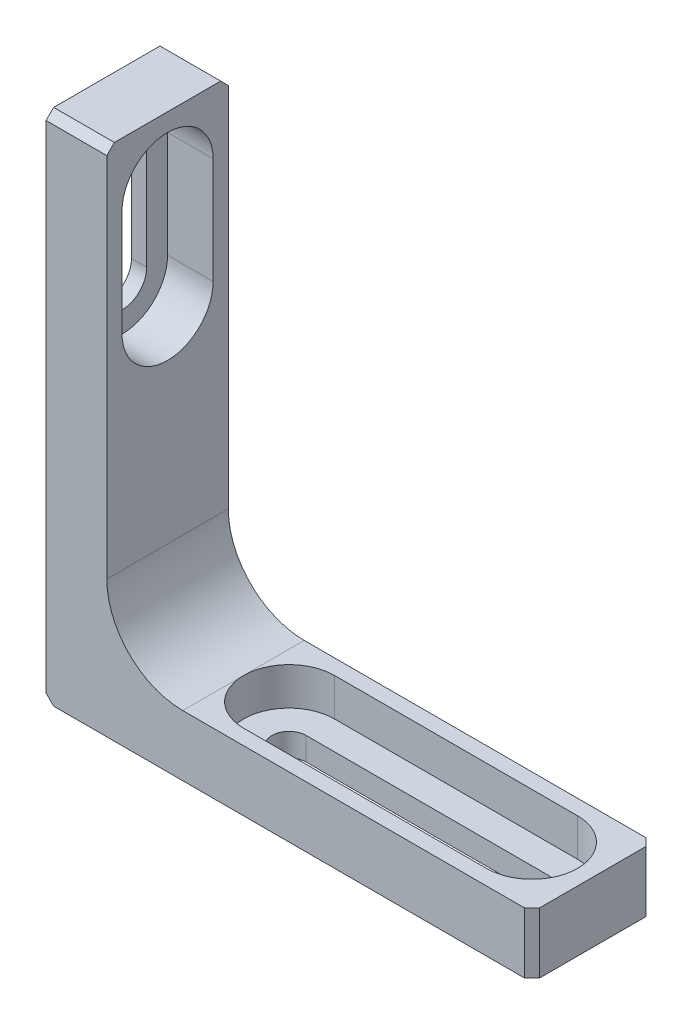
SolidWorks part; units mm, degrees
ref_plane "Front" through (0, 0, 0) normal (0, 0, 1) x (1, 0, 0)
ref_plane "Top" through (0, 0, 0) normal (0, 1, 0) x (1, 0, 0)
ref_plane "Right" through (0, 0, 0) normal (1, 0, 0) x (0, 0, -1)
sketch "Sketch1" plane through (0, 0, 0) normal (0, 0, 1) x (1, 0, 0)
  line L1 (0, 0) -> (101.6, 0)
  line L2 (0, 0) -> (0, 106.8288)
  line L3 (0, 106.8288) -> (101.6, 106.8288)
  line L4 (101.6, 0) -> (101.6, 106.8288)
  dimension "D1" = 106.8288
  dimension "D2" = 101.6
extrude "Boss-Extrude1" add sketch "Sketch1" along normal mid plane 25.4
sketch "Sketch2" plane through (0, 0, 0) normal (0, 0, 1) x (1, 0, 0)
  line L0 (0, 106.8288) -> (0, 0) construction
  line L1 (101.6, 106.8288) -> (12.7, 106.8288)
  line L2 (101.6, 106.8288) -> (101.6, 12.7)
  line L3 (101.6, 12.7) -> (28.575, 12.7)
  line L4 (12.7, 106.8288) -> (12.7, 28.575)
  line L5 (0, 0) -> (101.6, 0) construction
  arc A0 (28.575, 12.7) -> (12.7, 28.575) centre (28.575, 28.575) cw
  dimension "D3" = 15.875
  dimension "D1" = 12.7
  dimension "D2" = 12.7
extrude "Cut-Extrude1" cut sketch "Sketch2" against normal through all both and the other way through all
sketch "Sketch3" plane through (12.7, 0, 0) normal (1, 0, 0) x (0, 0, -1)
  line L0 (0, 106.8288) -> (0, 12.7) construction
  line L1 (12.7, 106.8288) -> (-12.7, 106.8288) construction
  line L2 (12.7, 12.7) -> (-12.7, 12.7) construction
  line L3 (0, 71.3323) -> (0, 93.5573) construction
  line L4 (-5.1562, 71.3323) -> (-5.1562, 93.5573)
  line L5 (5.1562, 71.3323) -> (5.1562, 93.5573)
  arc A0 (-5.1562, 71.3323) -> (5.1562, 71.3323) centre (0, 71.3323) ccw
  arc A1 (5.1562, 93.5573) -> (-5.1562, 93.5573) centre (0, 93.5573) ccw
  point P6 (0, 82.4448)
  dimension "D1" = 10.3124
  dimension "D2" = 22.225
  dimension "D3" = 11.1125
  dimension "D4" = 24.384
extrude "Cut-Extrude2" cut sketch "Sketch3" against normal through all both and the other way through all
sketch "Sketch4" plane through (0, 12.7, 0) normal (0, 1, 0) x (1, 0, 0)
  line L0 (101.6, 12.7) -> (101.6, -12.7) construction
  line L3 (38.1, 0) -> (88.9, 0) construction
  line L4 (38.1, 3.5687) -> (88.9, 3.5687)
  line L5 (38.1, -3.5687) -> (88.9, -3.5687)
  arc A0 (38.1, 3.5687) -> (38.1, -3.5687) centre (38.1, 0) ccw
  arc A1 (88.9, -3.5687) -> (88.9, 3.5687) centre (88.9, 0) ccw
  point P8 (63.5, 0)
  dimension "D1" = 7.1374
  dimension "D2" = 50.8
  dimension "D3" = 12.7
extrude "Cut-Extrude3" cut sketch "Sketch4" against normal through all both and the other way through all
sketch "Sketch5" plane through (0, 12.7, 0) normal (0, 1, 0) x (1, 0, 0)
  line L0 (38.1, 0) -> (88.9, 0) construction
  line L1 (38.1, 9.525) -> (88.9, 9.525)
  line L2 (38.1, -9.525) -> (88.9, -9.525)
  arc A0 (38.1, 9.525) -> (38.1, -9.525) centre (38.1, 0) ccw
  arc A1 (88.9, -9.525) -> (88.9, 9.525) centre (88.9, 0) ccw
  point P2 (63.5, 0)
  dimension "D1" = 19.05
  dimension "D2" = 50.8
extrude "Cut-Extrude4" cut sketch "Sketch5" against normal blind 7.874 and the other way through all
chamfer "Chamfer1" distance 1.5875 angle 45 5 edges at (101.6, 6.35, -12.7) (101.6, 6.35, 12.7) (6.35, 106.8288, -12.7) (6.35, 106.8288, 12.7) (0, 0, 0)
sketch "Sketch6" plane through (12.7, 0, 0) normal (1, 0, 0) x (0, 0, -1)
  line L0 (0, 71.3323) -> (0, 93.5573) construction
  line L2 (-9.525, 71.3323) -> (-9.525, 93.5573)
  line L3 (9.525, 71.3323) -> (9.525, 93.5573)
  arc A0 (-9.525, 71.3323) -> (9.525, 71.3323) centre (0, 71.3323) ccw
  arc A1 (9.525, 93.5573) -> (-9.525, 93.5573) centre (0, 93.5573) ccw
  point P5 (0, 82.4448)
  dimension "D1" = 19.05
  dimension "D2" = 22.225
extrude "Cut-Extrude5" cut sketch "Sketch6" against normal blind 9.525 and the other way through all
